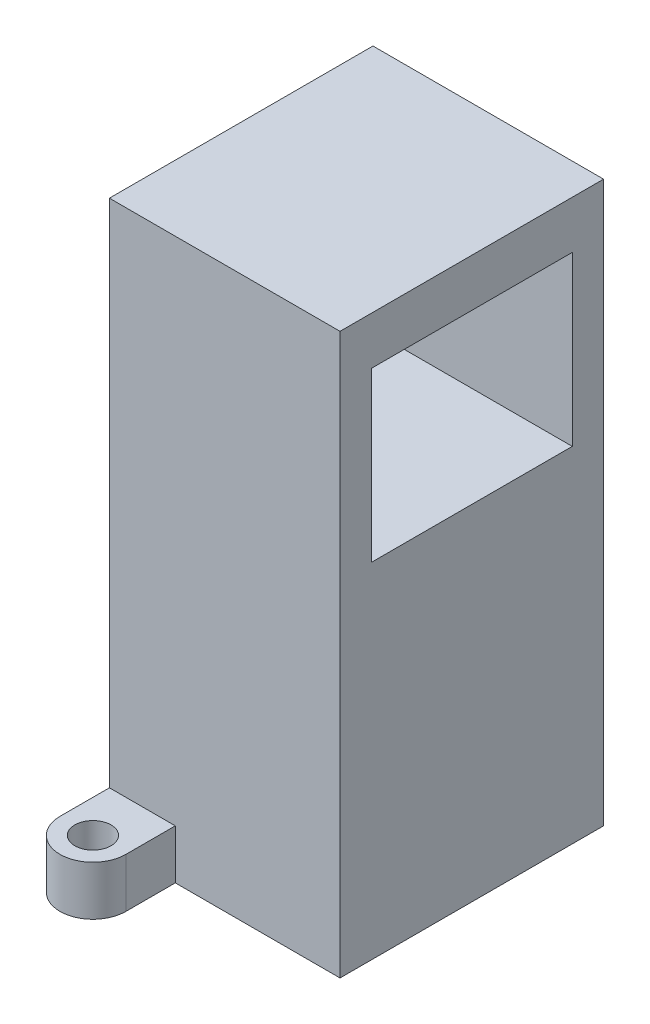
SolidWorks part; units mm, degrees
ref_plane "前视基准面" through (0, 0, 0) normal (0, 0, 1) x (1, 0, 0)
ref_plane "上视基准面" through (0, 0, 0) normal (0, 1, 0) x (1, 0, 0)
ref_plane "右视基准面" through (0, 0, 0) normal (1, 0, 0) x (0, 0, -1)
sketch "草图1" plane through (0, 0, 0) normal (0, 1, 0) x (1, 0, 0)
  line L0 (-31.6345, 0) -> (31.6345, 0) construction
  line L1 (0, 31.5533) -> (0, -31.5533) construction
  line L3 (-7, 8) -> (7, 8)
  line L4 (-7, 8) -> (-7, -8)
  line L5 (-7, -8) -> (7, -8)
  line L6 (7, 8) -> (7, -8)
  line L7 (-7, 8) -> (7, -8) construction
  line L8 (-7, -8) -> (7, 8) construction
  point P0 (0, 0)
  point P4 (0, 0)
  point P8 (0, 0)
  dimension "D1" = 16
  dimension "D2" = 14
extrude "凸台-拉伸1" add sketch "草图1" along normal blind 34
sketch "草图2" plane through (0, 0, 0) normal (1, 0, 0) x (0, 0, -1)
  line L0 (0, 0) -> (0, 36.7791) construction
  line L1 (-13.0606, 26) -> (13.0606, 26) construction
  line L2 (-8, 0) -> (8, 0) construction
  line L4 (-6.1, 31.1) -> (6.1, 31.1)
  line L5 (-6.1, 31.1) -> (-6.1, 20.9)
  line L6 (-6.1, 20.9) -> (6.1, 20.9)
  line L7 (6.1, 31.1) -> (6.1, 20.9)
  line L8 (-6.1, 31.1) -> (6.1, 20.9) construction
  line L9 (-6.1, 20.9) -> (6.1, 31.1) construction
  circle A1 centre (0, 26) radius 3.2856 construction
  point P6 (0, 26)
  point P8 (0, 26)
  dimension "D1" = 26
  dimension "D2" = 10.2
  dimension "D3" = 12.2
extrude "切除-拉伸1" cut sketch "草图2" against normal through all both and the other way through all
sketch "草图3" plane through (0, 0, 0) normal (0, 1, 0) x (1, 0, 0)
  line L0 (-7, 8) -> (-7, 11)
  line L2 (7, 8) -> (-7, 8) construction
  line L6 (-3, 11) -> (-3, 8)
  line L7 (-3, 8) -> (-7, 8)
  circle A2 centre (-5, 11) radius 1.1
  arc A3 (-3, 11) -> (-7, 11) centre (-5, 11) ccw
  point P4 (0, 0)
  dimension "D2" = 3
  dimension "D3" = 2.2
  dimension "D1" = 4
extrude "凸台-拉伸2" add sketch "草图3" along normal blind 3
mirror "镜向1" about plane through (0, 0, 0) normal (0, 0, 1) of "凸台-拉伸2"
sketch "Sketch1" plane through (-7, 0, 0) normal (-1, 0, 0) x (0, 0, 1)
  line L0 (0, 31.1) -> (0, 20.9) construction
  line L1 (-6.1, 31.1) -> (6.1, 31.1) construction
  line L2 (6.1, 20.9) -> (-6.1, 20.9) construction
  line L3 (-6.1, 26) -> (6.1, 26) construction
  line L4 (-6.1, 20.9) -> (-6.1, 31.1) construction
  line L5 (6.1, 31.1) -> (6.1, 20.9) construction
  circle A0 centre (0, 26) radius 1.2037 construction
